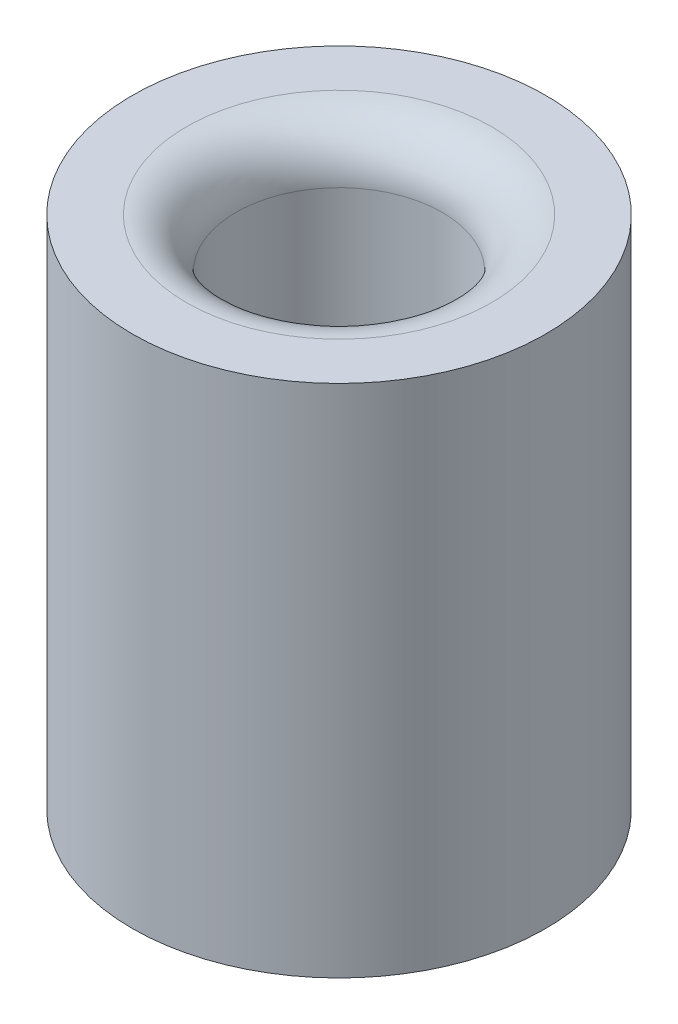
SolidWorks part; units mm, degrees
ref_plane "Front" through (0, 0, 0) normal (0, 0, 1) x (1, 0, 0)
ref_plane "Top" through (0, 0, 0) normal (0, 1, 0) x (1, 0, 0)
ref_plane "Right" through (0, 0, 0) normal (1, 0, 0) x (0, 0, -1)
sketch "Sketch1" plane through (0, 0, 0) normal (1, 0, 0) x (0, 0, -1)
  line L0 (0, 0) -> (0, -12.8706) construction
  line L1 (1.5888, 0) -> (1.5888, -7.9375)
  line L2 (1.5888, -7.9375) -> (3.1864, -7.9375)
  line L5 (3.1864, -7.9375) -> (3.1864, 0)
  line L6 (1.5888, 0) -> (3.1864, 0)
  dimension "D1" = 3.1775
  dimension "D2" = 7.9375
  dimension "D3" = 6.3729
revolve "Revolve1" add sketch "Sketch1" angle 360 about L0
fillet "Fillet1" radius 0.762 1 edges at (0, 0, 1.5888)
